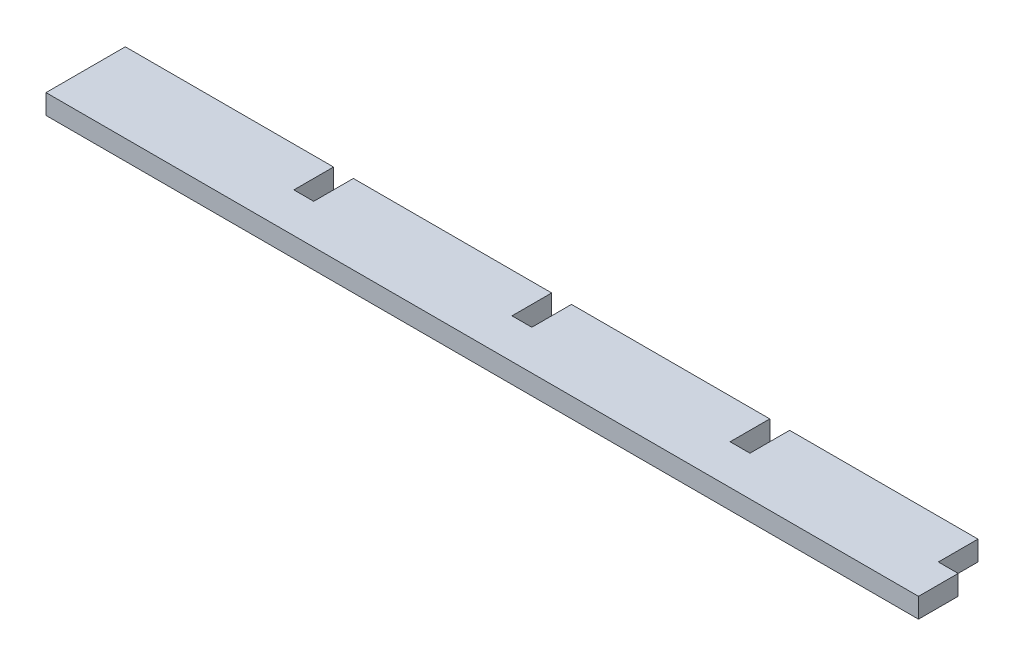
SolidWorks part; units mm, degrees
ref_plane "Front Plane" through (0, 0, 0) normal (0, 0, 1) x (1, 0, 0)
ref_plane "Top Plane" through (0, 0, 0) normal (0, 1, 0) x (1, 0, 0)
ref_plane "Right Plane" through (0, 0, 0) normal (1, 0, 0) x (0, 0, -1)
sketch "Sketch1" plane through (0, 0, 0) normal (0, 1, 0) x (1, 0, 0)
  line L0 (-279.4, 12.7) -> (0, 12.7) construction
  line L1 (0, 0) -> (-279.4, 0)
  line L2 (0, 0) -> (0, 25.4)
  line L3 (0, 25.4) -> (-279.4, 25.4)
  line L4 (-279.4, 0) -> (-279.4, 25.4)
  line L5 (-139.7, 25.4) -> (-139.7, 0) construction
  line L6 (-209.55, 25.4) -> (-209.55, 0) construction
  line L7 (-6.35, 25.4) -> (-6.35, 0)
  line L8 (-69.85, 25.4) -> (-69.85, 0) construction
  line L9 (-142.875, 25.4) -> (-136.525, 25.4)
  line L10 (-142.875, 25.4) -> (-142.875, 12.7)
  line L11 (-142.875, 12.7) -> (-136.525, 12.7)
  line L12 (-136.525, 25.4) -> (-136.525, 12.7)
  line L13 (-73.025, 25.4) -> (-66.675, 25.4)
  line L14 (-73.025, 25.4) -> (-73.025, 12.7)
  line L15 (-73.025, 12.7) -> (-66.675, 12.7)
  line L16 (-66.675, 25.4) -> (-66.675, 12.7)
  line L17 (-212.725, 25.4) -> (-206.375, 25.4)
  line L18 (-212.725, 25.4) -> (-212.725, 12.7)
  line L19 (-212.725, 12.7) -> (-206.375, 12.7)
  line L20 (-206.375, 25.4) -> (-206.375, 12.7)
  line L21 (-6.35, 12.7) -> (0, 12.7)
  dimension "D1" = 279.4
  dimension "D2" = 25.4
  dimension "D3" = 69.85
  dimension "D4" = 69.85
  dimension "D5" = 3.175
  dimension "D6" = 3.175
  dimension "D7" = 3.175
  dimension "D8" = 3.175
  dimension "D9" = 3.175
  dimension "D10" = 3.175
  dimension "D11" = 6.35
extrude "Boss-Extrude2" add sketch "Sketch1" along normal blind 6.35 contours L3 L20 L19 L18 L4 L1 L7 L16 L15 L14 L12 L11 L10 | L21 L7 L1 L2
